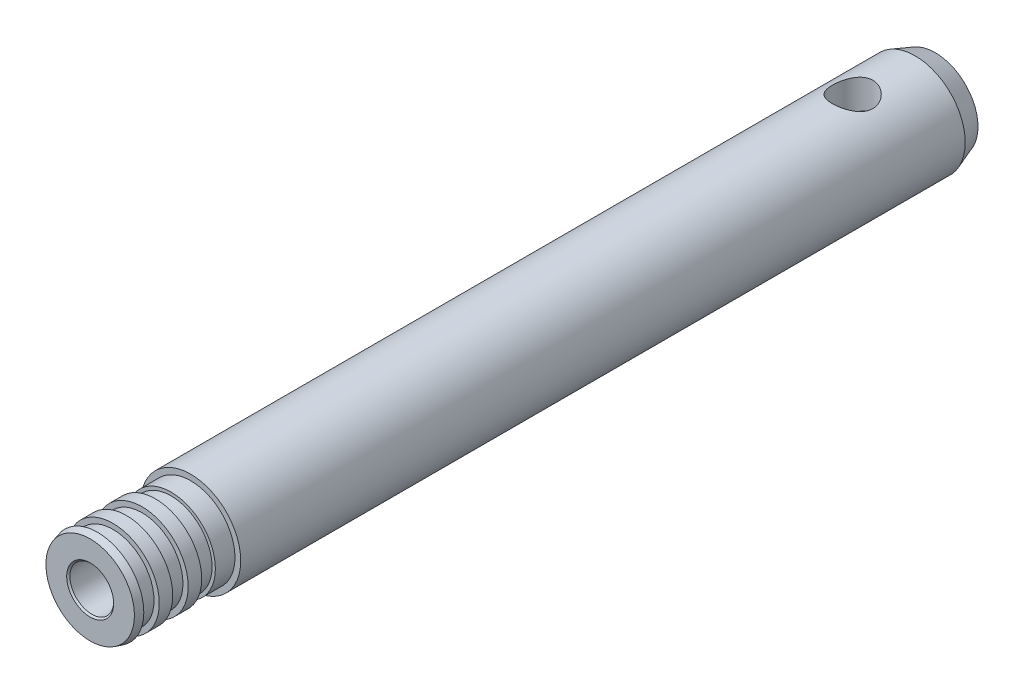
SolidWorks part; units mm, degrees
ref_plane "Front Plane" through (0, 0, 0) normal (0, 0, 1) x (1, 0, 0)
ref_plane "Top Plane" through (0, 0, 0) normal (0, 1, 0) x (1, 0, 0)
ref_plane "Right Plane" through (0, 0, 0) normal (1, 0, 0) x (0, 0, -1)
sketch "Sketch1" plane through (0, 0, 0) normal (0, 0, 1) x (1, 0, 0)
  circle A0 centre (0, 0) radius 1.7272
  circle A1 centre (0, 0) radius 3.9497
  dimension "Inside Diameter" = 3.4544
  dimension "Outside Diameter" = 7.8994
extrude "ShankLength" add sketch "Sketch1" along normal blind 58.801
chamfer "Chamfer1" distance 1.5875 angle 20 1 edges at (3.9497, 0, 0)
chamfer "Chamfer2" distance 0.127 angle 45 1 edges at (1.7272, 0, 0)
ref_plane "Plane-BallLocation" through (0, 0, 8.128) normal (0, 0, 1) x (1, 0, 0)
sketch "Sketch-BallTrackDiameter" plane through (0, 0, 0) normal (0, 1, 0) x (1, 0, 0)
  line L0 (0, -58.801) -> (0, -0.127) construction
  line L2 (-3.1869, -8.128) -> (3.1869, -8.128) construction
  circle A0 centre (0, -6.528) radius 1.6
  dimension "D1" = 3.2
extrude "Extrude1" cut sketch "Sketch-BallTrackDiameter" against normal through all and the other way through all
sketch "Sketch9" plane through (0, 0, 58.801) normal (0, 0, 1) x (1, 0, 0)
  circle A0 centre (0, 0) radius 1.7272 construction
  circle A1 centre (0, 0) radius 1.7272
  circle A2 centre (0, 0) radius 3.6512
  dimension "D1" = 7.3025
extrude "Extrude2" add sketch "Sketch9" along normal blind 7.9375
sketch "Sketch12" plane through (0, 0, 0) normal (1, 0, 0) x (0, 0, -1)
  line L0 (-58.801, 3.6513) -> (-66.7385, 3.6513) construction
  line L1 (-58.801, 3.6513) -> (-66.7385, 3.6513)
  line L3 (-58.801, 3.6513) -> (-60.3504, 3.6513)
  line L4 (-58.801, 3.6513) -> (-58.801, 3.4989)
  line L5 (-58.801, 3.4989) -> (-60.3504, 3.4989)
  line L6 (-60.3504, 3.6513) -> (-60.3504, 3.4989)
  dimension "D1" = 1.5494
  dimension "D2" = 0.1524
revolve "Cut-Revolve2" cut sketch "Sketch12" angle 360 about axis through (0, 0, 58.801) along (0, 0, -1)
sketch "Sketch13" plane through (0, 0, 0) normal (1, 0, 0) x (0, 0, -1)
  line L0 (-60.3504, 3.6513) -> (-66.7385, 3.6513) construction
  line L1 (-60.3504, 3.6513) -> (-66.7385, 3.6513)
  line L2 (-66.7385, 3.6513) -> (-66.7385, -3.6513) construction
  line L3 (-66.7385, 3.6513) -> (-66.7385, -3.6513)
  line L4 (-66.7385, 0) -> (-69.8209, 0) construction
  line L7 (-62.6491, 3.6513) -> (-63.8683, 3.6513)
  line L8 (-62.6491, 3.6513) -> (-62.6491, 3.2385)
  line L9 (-62.6491, 3.2385) -> (-63.8683, 3.2385)
  line L10 (-63.8683, 3.6513) -> (-63.8683, 3.2385)
  line L11 (-66.1543, 3.6513) -> (-64.9351, 3.6513)
  line L12 (-66.1543, 3.6513) -> (-66.1543, 3.2385)
  line L13 (-66.1543, 3.2385) -> (-64.9351, 3.2385)
  line L14 (-64.9351, 3.6513) -> (-64.9351, 3.2385)
  line L15 (-60.3504, 3.6513) -> (-61.5823, 3.6513)
  line L16 (-60.3504, 3.6513) -> (-60.3504, 3.2385)
  line L17 (-60.3504, 3.2385) -> (-61.5823, 3.2385)
  line L18 (-61.5823, 3.6513) -> (-61.5823, 3.2385)
  dimension "D1" = 6.477
  dimension "D4" = 0.5842
  dimension "D2" = 1.2192
  dimension "D3" = 1.2319
revolve "Cut-Revolve3" cut sketch "Sketch13" angle 360 about axis through (0, 0, 66.7385) along (0, 0, -1)
chamfer "Chamfer3" distance 0.127 angle 45 1 edges at (1.7272, 0, 66.7385)
ref_plane "Plane3" through (0, 2.2372, 4.928) normal (0, 0, 1) x (1, 0, 0)
sketch "Sketch15" plane through (0, 0, 0) normal (1, 0, 0) x (0, 0, -1)
  line L0 (-66.1543, 3.6513) -> (-66.7385, 3.6513) construction
  line L1 (-66.1543, 3.6513) -> (-66.7385, 3.6513)
  line L2 (-66.1543, 3.6513) -> (-66.7385, 3.4947)
  line L3 (-66.7385, 3.4947) -> (-66.7385, 3.6513)
  dimension "D1" = 15
revolve "Cut-Revolve5" cut sketch "Sketch15" angle 360 about axis through (0, 0, 66.7385) along (0, 0, -1)
